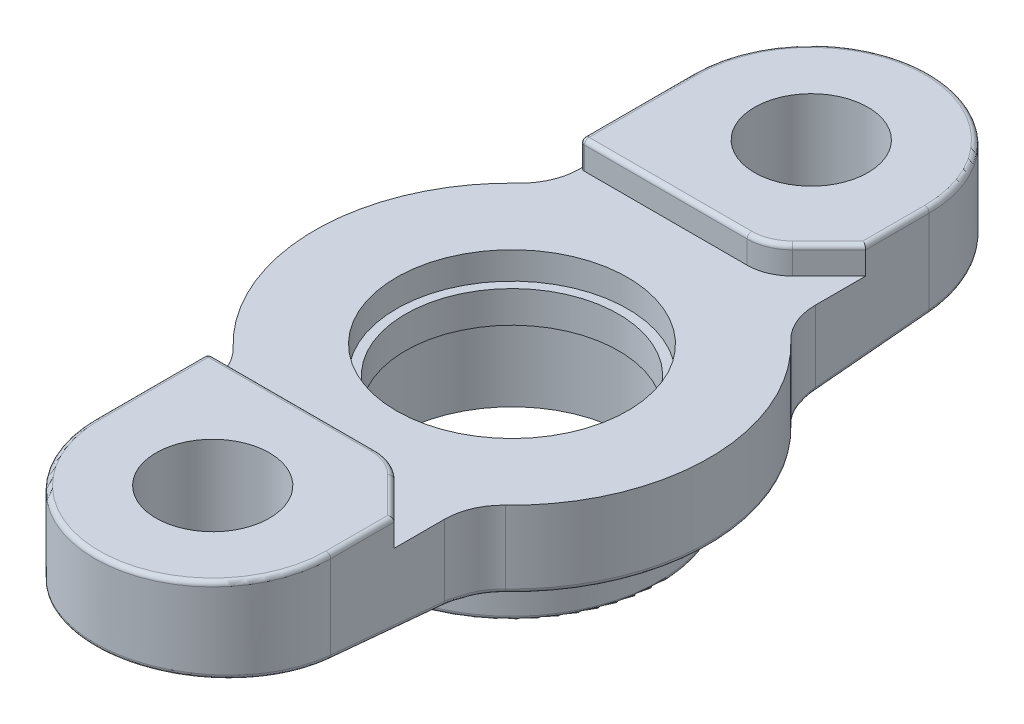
SolidWorks part; units mm, degrees
ref_plane "前基準面" through (0, 0, 0) normal (0, 0, 1) x (1, 0, 0)
ref_plane "上基準面" through (0, 0, 0) normal (0, 1, 0) x (1, 0, 0)
ref_plane "右基準面" through (0, 0, 0) normal (1, 0, 0) x (0, 0, -1)
sketch "草圖2" plane through (0, 0, 0) normal (0, 1, 0) x (1, 0, 0)
  line L0 (0, 51.6337) -> (0, -53.2055) construction
  line L1 (-14.1448, 33) -> (9.6948, 33) construction
  line L2 (-14.1448, -33) -> (9.6948, -33) construction
  line L3 (-16.1531, 0) -> (15.1304, 0) construction
  line L4 (13, 33) -> (13, 20.4405)
  line L5 (-13, 33) -> (-13, 20.4405)
  line L6 (-13, -33) -> (-13, -20.4405)
  line L7 (13, -33) -> (13, -20.4405)
  circle A0 centre (0, 33) radius 6.25
  arc A1 (13, 33) -> (-13, 33) centre (0, 33) ccw
  arc A2 (-15.0133, 15.7373) -> (-15.0133, -15.7373) centre (0, 0) ccw
  arc A3 (13, 20.4405) -> (15.0133, 15.7373) centre (19.5, 20.4405) ccw
  arc A4 (-13, 20.4405) -> (-15.0133, 15.7373) centre (-19.5, 20.4405) cw
  arc A5 (-13, -20.4405) -> (-15.0133, -15.7373) centre (-19.5, -20.4405) ccw
  arc A6 (13, -20.4405) -> (15.0133, -15.7373) centre (19.5, -20.4405) cw
  arc A7 (13, -33) -> (-13, -33) centre (0, -33) cw
  circle A8 centre (0, -33) radius 6.25
  arc A9 (15.0133, -15.7373) -> (15.0133, 15.7373) centre (0, 0) ccw
  dimension "D2" = 12.5
  dimension "D3" = 26
  dimension "D4" = 43.5
  dimension "D5" = 6.5
  dimension "D1" = 66
extrude "伸長1" add sketch "草圖2" against normal blind 11.5
sketch "草圖3" plane through (0, 0, 0) normal (1, 0, 0) x (0, 0, -1)
  line L0 (0, 8.4263) -> (0, -19.9222) construction
  line L1 (0, 0) -> (18.75, 0)
  line L2 (15.7373, 0) -> (-15.7373, 0) construction
  line L3 (18.75, 0) -> (18.75, -13.5)
  line L4 (18.75, -13.5) -> (16.25, -13.5)
  line L5 (16.25, -13.5) -> (16.25, -18)
  line L6 (16.25, -18) -> (0, -18)
  line L7 (0, -18) -> (0, 0)
  dimension "D1" = 37.5
  dimension "D2" = 32.5
  dimension "D3" = 18
  dimension "D4" = 13.5
revolve "旋轉1" add sketch "草圖3" angle 360 about L0
sketch "草圖5" plane through (0, 0, 0) normal (1, 0, 0) x (0, 0, -1)
  line L0 (0, 3.9895) -> (0, -20.503) construction
  line L1 (-20.5, 0) -> (-20.5, -3)
  line L4 (-20.5, -3) -> (20.5, -3)
  line L6 (20.5, 0) -> (-20.5, 0)
  line L9 (20.5, 0) -> (20.5, -3)
  point P5 (0, 0)
  point P11 (0, -3)
  dimension "D1" = 41
  dimension "D3" = 3
extrude "除料-伸長1" cut sketch "草圖5" against normal mid plane 47
sketch "草圖6" plane through (0, 0, 0) normal (0, 1, 0) x (-1, 0, 0)
  line L0 (0, -29.0583) -> (0, 26) construction
  line L1 (-17.8031, 0) -> (16.6705, 0) construction
  line L2 (-13, 20.5) -> (-7.5, 20.5)
  line L3 (-13, -26) -> (-7.5, -20.5)
  line L4 (-13, 26) -> (-13, 20.5)
  line L5 (-13, 33) -> (-13, 20.5) construction
  line L6 (-13, -26) -> (-13, -20.5)
  line L7 (-13, -20.5) -> (-7.5, -20.5)
  line L8 (13, 20.5) -> (-13, 20.5) construction
  line L10 (-13, 26) -> (-7.5, 20.5)
  dimension "D1" = 52
  dimension "D2" = 45
extrude "除料-伸長2" cut sketch "草圖6" against normal up to surface (3 mm away)
sketch "草圖7" plane through (0, -11.5, 0) normal (0, -1, 0) x (1, 0, 0)
  line L0 (0, 29.483) -> (0, -30.1909) construction
  line L1 (17.4491, 0) -> (-17.0952, 0) construction
  line L2 (9, 33) -> (9, 21.297)
  line L3 (-9, 33) -> (-9, 21.297)
  line L4 (-9, -33) -> (-9, -21.297)
  line L5 (9, -33) -> (9, -21.297)
  arc A0 (7.6484, 20.3609) -> (-7.6484, 20.3609) centre (0, 0) ccw
  arc A1 (9, 33) -> (-9, 33) centre (0, 33) ccw
  arc A2 (7.6484, 20.3609) -> (9, 21.297) centre (8, 21.297) ccw
  circle A3 centre (0, 33) radius 6.25 construction
  arc A4 (-7.6484, 20.3609) -> (-9, 21.297) centre (-8, 21.297) cw
  arc A6 (-7.6484, -20.3609) -> (-9, -21.297) centre (-8, -21.297) ccw
  arc A8 (7.6484, -20.3609) -> (9, -21.297) centre (8, -21.297) cw
  arc A9 (9, -33) -> (-9, -33) centre (0, -33) cw
  arc A10 (7.6484, -20.3609) -> (-7.6484, -20.3609) centre (0, 0) cw
  dimension "D1" = 43.5
  dimension "D2" = 18
  dimension "D3" = 2
extrude "除料-伸長3" cut sketch "草圖7" against normal blind 2.5
sketch "草圖8" plane through (0, 0, 0) normal (1, 0, 0) x (0, 0, -1)
  line L0 (-18.75, -11.5) -> (-46, -9)
  line L2 (-46, -9) -> (-46, -11.5)
  line L3 (-46, -11.5) -> (-18.75, -11.5)
  line L4 (-46, 0) -> (-46, -11.5) construction
  line L5 (0, 4.9668) -> (0, -21.9373) construction
  line L6 (46, -11.5) -> (18.75, -11.5)
  line L7 (46, -9) -> (46, -11.5)
  line L8 (18.75, -11.5) -> (46, -9)
  dimension "D1" = 2.5
extrude "除料-伸長4" cut sketch "草圖8" against normal mid plane 31.7
sketch "草圖9" plane through (0, 0, 0) normal (1, 0, 0) x (0, 0, -1)
  line L0 (0, 5.83) -> (0, -23.6884) construction
  line L1 (0, -3) -> (12.75, -3)
  line L3 (15.7373, -3) -> (-15.7373, -3) construction
  line L4 (12.75, -3) -> (12.75, -6)
  line L6 (12.75, -6) -> (11.75, -6)
  line L7 (11.75, -6) -> (11.75, -9.5)
  line L8 (11.75, -9.5) -> (12.75, -9.5)
  line L9 (12.75, -9.5) -> (12.75, -18)
  line L10 (-16.25, -18) -> (16.25, -18) construction
  line L11 (12.75, -18) -> (0, -18)
  line L12 (0, -18) -> (0, -3)
  dimension "D1" = 6
  dimension "D2" = 9.5
  dimension "D3" = 25.5
  dimension "D4" = 23.5
  dimension "D5" = 25.5
revolve "除料-旋轉1" cut sketch "草圖9" angle 360 about L0
fillet "圓角2" radius 5 2 edges at (7.5, -1.5, 20.5) (7.5, -1.5, -20.5)
fillet "圓角1" radius 0.5 16 edges at (0, -13.5, 18.75) (0, -18, 16.25) (8.5694, -9, -20.4749) (9, -9, -27.1485) (0, -9, -42) (-9, -9, -27.1485) (-8.5694, -9, -20.4749) (-8.5694, -9, 20.4749) (-9, -9, 27.1485) (0, -9, 42) (9, -9, 27.1485) (8.5694, -9, 20.4749) (0, -9, -21.75) (0, -9, 21.75) (-13, -1.5, 20.5) (-13, -1.5, -20.5)
fillet "圓角3" radius 0.5 46 edges at (8.5694, -11.3418, 20.4749) (0, -11.2248, 21.75) (-8.5694, -11.3418, 20.4749) (-9, -10.7295, 27.1485) (-7.9085, -9.7985, 37.296) (0, -9.367, 42) (7.9085, -9.7985, 37.296) (-8.5694, -11.3418, -20.4749) (0, -11.2248, -21.75) (8.5694, -11.3418, -20.4749) (9, -10.7295, -27.1485) (7.9085, -9.7985, -37.296) (0, -9.367, -42) (-7.9085, -9.7985, -37.296) (13, 0, -29.5) (0, 0, -46) (10.9822, 0, -23.9822) (7.3423, 0, -20.8806) (-3.5355, 0, -20.5) (10.9822, 0, 23.9822) (7.3423, 0, 20.8806) (-3.5355, 0, 20.5) (13, 0, 29.5) (0, 0, 46) (9, -10.7295, 27.1485) (-9, -10.7295, -27.1485) (-13, 0, -27) (-13, 0, 27) (13.9116, -11.5, 17.1208) (13.9116, -11.5, -17.1208) (13.0562, -11.4231, 19.5879) (13, -10.7688, 26.7202) (0, -9, 46) (-13.0562, -11.4231, 19.5879) (-13.0562, -11.4231, -19.5879) (13.0562, -11.4231, -19.5879) (13, -10.7688, -26.7202) (0, -9, -46) (-13.9116, -11.5, -17.1208) (-13.9116, -11.5, 17.1208) (21.75, -11.5, 0) (-13, -10.7688, 26.7202) (-13, -10.7688, -26.7202) (-21.75, -11.5, 0) (-12.8536, 0, -20.6464) (-12.8536, 0, 20.6464)
